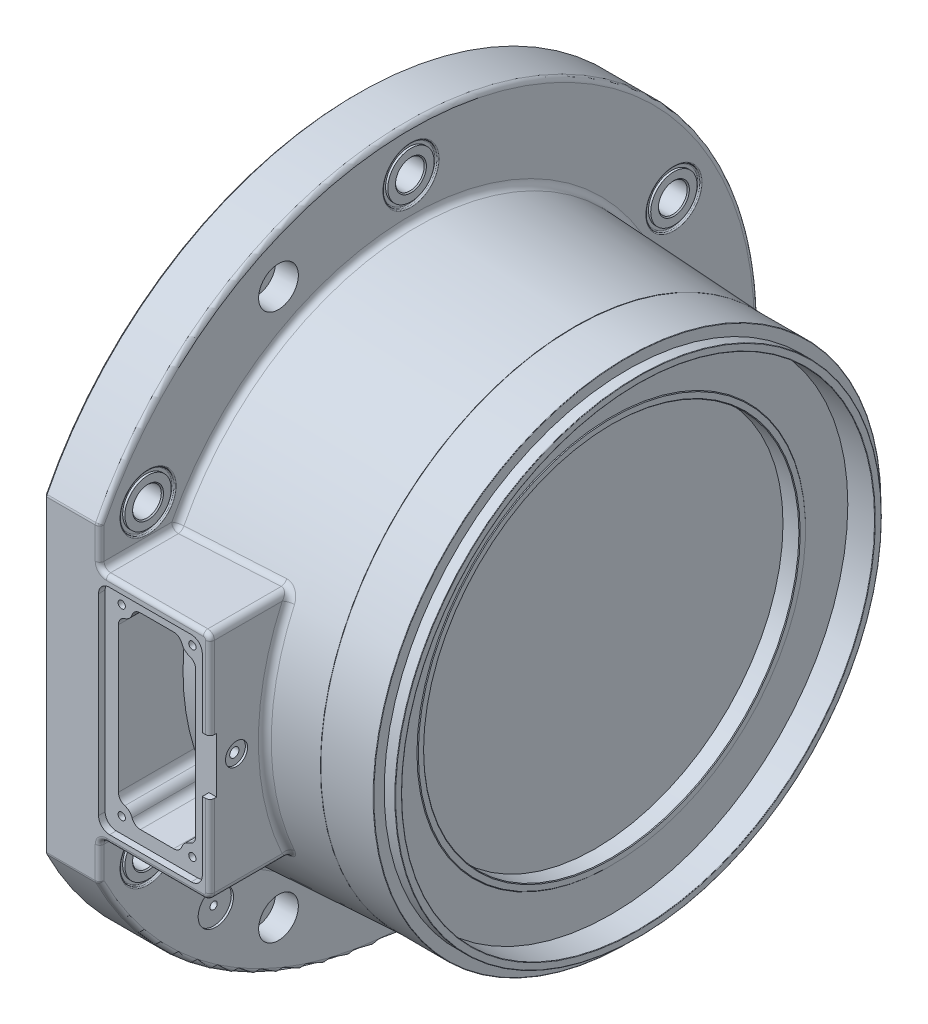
SolidWorks part; units mm, degrees
ref_plane "前视基准面" through (0, 0, 0) normal (0, 0, 1) x (1, 0, 0)
ref_plane "上视基准面" through (0, 0, 0) normal (0, 1, 0) x (1, 0, 0)
ref_plane "右视基准面" through (0, 0, 0) normal (1, 0, 0) x (0, 0, -1)
imported_body "N40-基座V2.0-1-solid1"
imported_body "N40-再生制动固定板-1-solid1"
imported_body "N40-基座PCB-1-solid1"
imported_body "十字沉头螺钉M4X10-304-1-solid1"
imported_body "十字盘头螺钉M3x6-1-solid1"
imported_body "十字盘头螺钉M3x6-2-solid1"
imported_body "十字盘头螺钉M3x6-3-solid1"
imported_body "G40-基座灯带装饰环-1-solid1"
sketch "草图1" plane through (0, 0, 0) normal (0, 1, 0) x (1, 0, 0)
  line L0 (0, 0) -> (81.8509, 0) construction
  line L1 (28.5, 85) -> (28.5, 0)
  line L2 (28.5, -85) -> (28.5, 85) construction
  line L3 (28.5, -65) -> (28.5, 65) construction
  line L4 (28.5, 0) -> (-66.736, 0)
  line L5 (-66.736, 0) -> (-66.736, 108.7309)
  line L6 (-66.736, 108.7309) -> (35.7, 108.7309)
  line L7 (35.7, 108.7309) -> (35.7, 85)
  line L8 (35.7, -88) -> (35.7, 88) construction
  line L9 (35.7, -85) -> (35.7, 85) construction
  line L10 (35.7, 85) -> (28.5, 85)
revolve "旋转1" add sketch "草图1" angle 360 about L0
